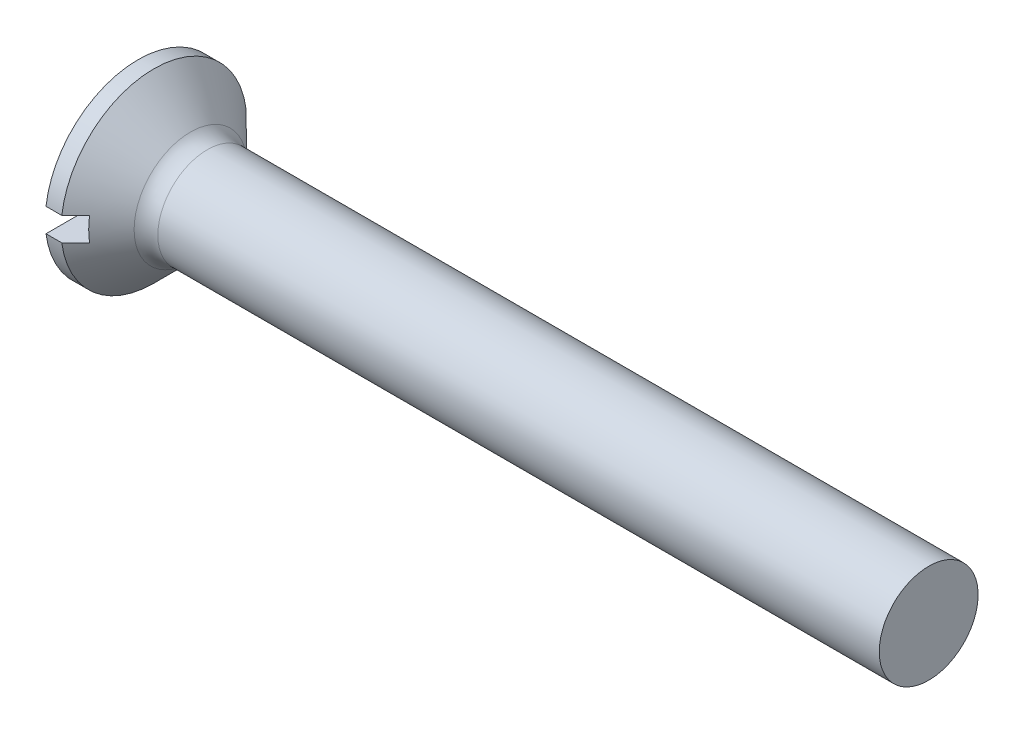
SolidWorks part; units mm, degrees
ref_plane "Plane1" through (0, 0, 0) normal (0, 0, 1) x (1, 0, 0)
ref_plane "Plane2" through (0, 0, 0) normal (0, 1, 0) x (1, 0, 0)
ref_plane "Plane3" through (0, 0, 0) normal (1, 0, 0) x (0, 0, -1)
revolve "Base-Revolve" add sketch "BodySke" angle 360 about L5
sketch "BodySke" plane through (0, 0, 0) normal (0, 0, 1) x (1, 0, 0)
  line L0 (0, 0) -> (0, 2.35)
  line L1 (0, 2.35) -> (0.4, 2.35)
  line L2 (1.5, 1.25) -> (20, 1.25)
  line L3 (20, 1.25) -> (20, 0)
  line L4 (20, 0) -> (0, 0)
  line L5 (-6.35, 0) -> (82.55, 0) construction
  line L6 (1.5, -1.25) -> (20, -1.25) construction
  line L7 (0.4, -2.35) -> (1.5, -1.25) construction
  line L8 (0.4, 2.35) -> (1.5, 1.25)
  line L9 (0, -2.35) -> (0.4, -2.35) construction
  line L10 (1.95, 2.8375) -> (1.95, -6.6875) construction
  line L11 (0, 6.35) -> (0, -3.175) construction
  dimension "Diameter" = 2.5
  dimension "Length" = 20
  dimension "Head_ht" = 1.5
  dimension "Head_dia" = 4.7
  dimension "Head_ang" = 90
  dimension "D6" = 0.4
  dimension "Advance" = 0.45
  dimension "Thread_nom" = 20
extrude "Slot" cut sketch "Sketch2" against normal blind 0.75
sketch "Sketch2" plane through (0, 0, 0) normal (-1, 0, 0) x (0, 0, 1)
  line L0 (-2.35, -0.3) -> (2.35, -0.3)
  line L1 (-2.35, -0.3) -> (-2.35, 0.3)
  line L2 (2.35, 0.3) -> (-2.35, 0.3)
  line L3 (2.35, 0.3) -> (2.35, -0.3)
  dimension "D1" = 0.3
  dimension "Slot_width" = 0.6
  dimension "D2" = 4.7
  dimension "D3" = 2.35
fillet "Fillet1" radius 0.6 1 edges at (1.5, 0, 1.25)
sketch "ThdSchSke" plane through (0, 0, 0) normal (0, 0, 1) x (1, 0, 0)
  line L0 (1.95, -0.9965) -> (1.7725, -1.25)
  line L1 (1.95, -0.9965) -> (2.1275, -1.25)
  line L2 (2.1275, -1.25) -> (2.1275, -1.5625)
  line L3 (-3.175, 0) -> (5.1513, 0) construction
  line L5 (2.1275, -1.5625) -> (1.7725, -1.5625)
  line L6 (1.7725, -1.5625) -> (1.7725, -1.25)
  line L7 (0, 2.35) -> (0, 0.3) construction
  dimension "Thread_minor" = 1.993
  dimension "Diameter" = 2.5
  dimension "Start" = 1.95
  dimension "SideAngle" = 55
  dimension "VeeAngle" = 70
  dimension "Overcut" = 3.125
revolve "ThreadSchematic" cut sketch "ThdSchSke" angle 360 about L3
pattern_linear "ThdSchPat"
equation "\"D1@Sketch2\" = \"Slot_width@Sketch2\" / 2"
equation "\"D2@Sketch2\" = \"Head_dia@BodySke\""
equation "\"D3@Sketch2\" = \"D2@Sketch2\" / 2"
equation "\"Thread_length@ThreadCosmetic\" = ((sgn( (\"Length@BodySke\" - \"Advance@BodySke\" * 1.0 - \"Head_ht@BodySke\" ) - \"Thread_nom@BodySke\" )-1)*( (\"Length@BodySke\" - \"Advance@BodySke\" * 1.0 - \"Head_ht@BodySke\" "
equation "\"Thread_minor@ThdSchSke\" = \"Thread_minor@ThreadCosmetic\""
equation "\"Diameter@ThdSchSke\" = \"Diameter@BodySke\""
equation "\"Overcut@ThdSchSke\" = \"Diameter@BodySke\" * 1.25"
equation "\"Start@ThdSchSke\" = 0.000001 + \"Length@BodySke\" - \"Thread_length@ThreadCosmetic\"  '---Countersunk---"
equation "\"Num_threads@ThdSchPat\" = int( \"Thread_length@ThreadCosmetic\" / \"Advance@BodySke\" + 0.999 )  + 1"
equation "\"Advance@ThdSchPat\" = \"Thread_length@ThreadCosmetic\" /  (\"Num_threads@ThdSchPat\" - 1) 'relax it"
